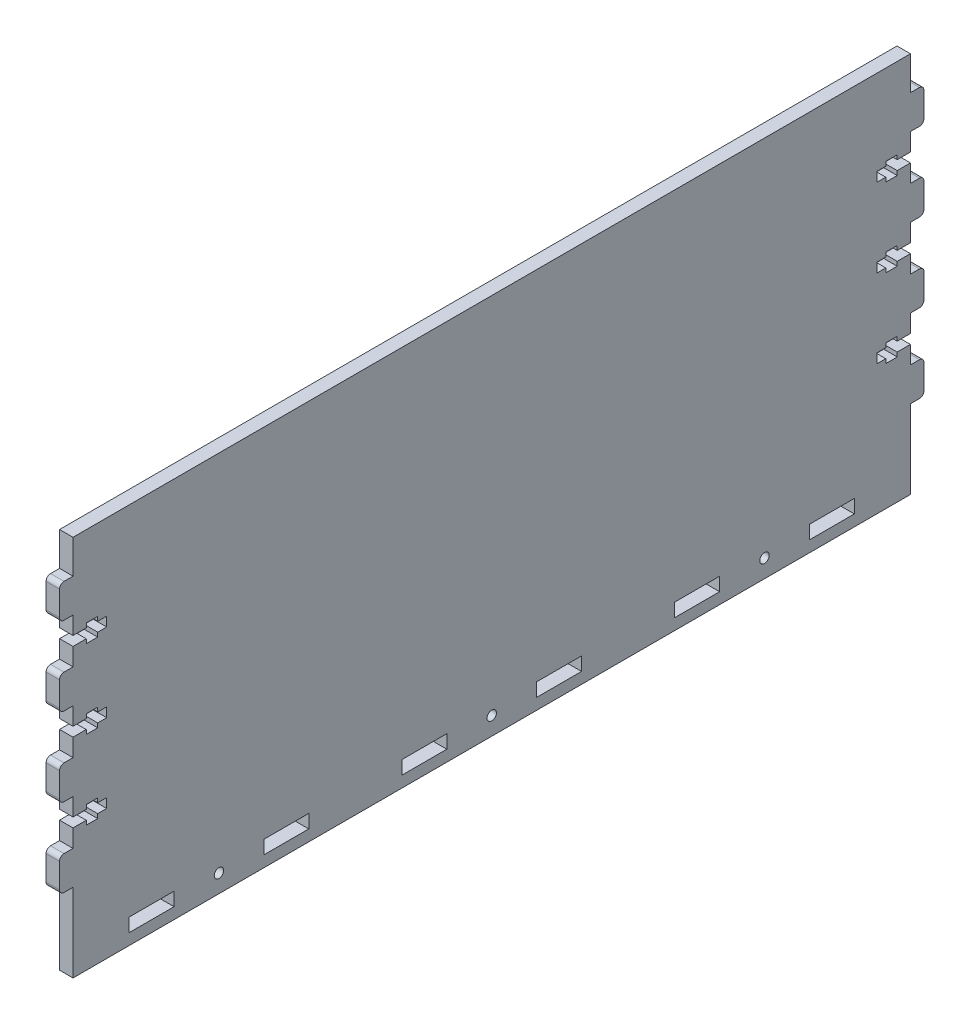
SolidWorks part; units mm, degrees
ref_plane "Спереди" through (0, 0, 0) normal (0, 0, 1) x (1, 0, 0)
ref_plane "Сверху" through (0, 0, 0) normal (0, 1, 0) x (1, 0, 0)
ref_plane "Справа" through (0, 0, 0) normal (1, 0, 0) x (0, 0, -1)
sketch "Эскиз1" plane through (0, 0, 0) normal (1, 0, 0) x (0, 0, -1)
  line L0 (186.5, 170) -> (186.5, 217.3961) construction
  line L1 (0, 0) -> (373, 0)
  line L2 (0, 0) -> (0, 170)
  line L3 (0, 170) -> (373, 170)
  line L4 (373, 0) -> (373, 170)
  line L5 (0, 155) -> (-4, 155)
  line L6 (0, 155) -> (0, 140)
  line L7 (0, 140) -> (-4, 140)
  line L8 (-6, 153) -> (-6, 142)
  line L9 (0, 120) -> (-4, 120)
  line L10 (0, 120) -> (0, 105)
  line L11 (0, 105) -> (-4, 105)
  line L12 (-6, 118) -> (-6, 107)
  line L13 (0, 85) -> (-4, 85)
  line L14 (0, 85) -> (0, 70)
  line L15 (0, 70) -> (-4, 70)
  line L16 (-6, 83) -> (-6, 72)
  line L17 (0, 50) -> (-4, 50)
  line L18 (0, 50) -> (0, 35)
  line L19 (0, 35) -> (-4, 35)
  line L20 (-6, 48) -> (-6, 37)
  line L21 (0, 132.1) -> (15, 132.1)
  line L22 (0, 132.1) -> (0, 127.9)
  line L23 (0, 127.9) -> (15, 127.9)
  line L24 (15, 132.1) -> (15, 127.9)
  line L25 (5.9, 134) -> (11, 134)
  line L26 (5.9, 134) -> (5.9, 126)
  line L27 (5.9, 126) -> (11, 126)
  line L28 (11, 134) -> (11, 126)
  line L29 (0, 62.1) -> (15, 62.1)
  line L30 (0, 62.1) -> (0, 57.9)
  line L31 (0, 57.9) -> (15, 57.9)
  line L32 (15, 62.1) -> (15, 57.9)
  line L33 (5.9, 64) -> (11, 64)
  line L34 (5.9, 64) -> (5.9, 56)
  line L35 (5.9, 56) -> (11, 56)
  line L36 (11, 64) -> (11, 56)
  line L37 (0, 97.1) -> (15, 97.1)
  line L38 (0, 97.1) -> (0, 92.9)
  line L39 (0, 92.9) -> (15, 92.9)
  line L40 (15, 97.1) -> (15, 92.9)
  line L41 (5.9, 99) -> (11, 99)
  line L42 (5.9, 99) -> (5.9, 91)
  line L43 (5.9, 91) -> (11, 91)
  line L44 (11, 99) -> (11, 91)
  line L45 (362, 99) -> (362, 91)
  line L46 (367.1, 91) -> (362, 91)
  line L47 (367.1, 99) -> (367.1, 91)
  line L48 (367.1, 99) -> (362, 99)
  line L49 (358, 97.1) -> (358, 92.9)
  line L50 (373, 92.9) -> (358, 92.9)
  line L51 (373, 97.1) -> (373, 92.9)
  line L52 (373, 97.1) -> (358, 97.1)
  line L53 (362, 64) -> (362, 56)
  line L54 (367.1, 56) -> (362, 56)
  line L55 (367.1, 64) -> (367.1, 56)
  line L56 (367.1, 64) -> (362, 64)
  line L57 (358, 62.1) -> (358, 57.9)
  line L58 (373, 57.9) -> (358, 57.9)
  line L59 (373, 62.1) -> (373, 57.9)
  line L60 (373, 62.1) -> (358, 62.1)
  line L61 (362, 134) -> (362, 126)
  line L62 (367.1, 126) -> (362, 126)
  line L63 (367.1, 134) -> (367.1, 126)
  line L64 (367.1, 134) -> (362, 134)
  line L65 (358, 132.1) -> (358, 127.9)
  line L66 (373, 127.9) -> (358, 127.9)
  line L67 (373, 132.1) -> (373, 127.9)
  line L68 (373, 132.1) -> (358, 132.1)
  line L69 (379, 48) -> (379, 37)
  line L70 (373, 35) -> (377, 35)
  line L71 (373, 50) -> (373, 35)
  line L72 (373, 50) -> (377, 50)
  line L73 (379, 83) -> (379, 72)
  line L74 (373, 70) -> (377, 70)
  line L75 (373, 85) -> (373, 70)
  line L76 (373, 85) -> (377, 85)
  line L77 (379, 118) -> (379, 107)
  line L78 (373, 105) -> (377, 105)
  line L79 (373, 120) -> (373, 105)
  line L80 (373, 120) -> (377, 120)
  line L81 (379, 153) -> (379, 142)
  line L82 (373, 140) -> (377, 140)
  line L83 (373, 155) -> (373, 140)
  line L84 (373, 155) -> (377, 155)
  arc A0 (-4, 155) -> (-6, 153) centre (-4, 153) ccw
  arc A1 (-4, 140) -> (-6, 142) centre (-4, 142) cw
  arc A2 (-4, 120) -> (-6, 118) centre (-4, 118) ccw
  arc A3 (-4, 105) -> (-6, 107) centre (-4, 107) cw
  arc A4 (-4, 85) -> (-6, 83) centre (-4, 83) ccw
  arc A5 (-4, 70) -> (-6, 72) centre (-4, 72) cw
  arc A6 (-4, 50) -> (-6, 48) centre (-4, 48) ccw
  arc A7 (-4, 35) -> (-6, 37) centre (-4, 37) cw
  arc A8 (377, 35) -> (379, 37) centre (377, 37) ccw
  arc A9 (377, 50) -> (379, 48) centre (377, 48) cw
  arc A10 (377, 70) -> (379, 72) centre (377, 72) ccw
  arc A11 (377, 85) -> (379, 83) centre (377, 83) cw
  arc A12 (377, 105) -> (379, 107) centre (377, 107) ccw
  arc A13 (377, 120) -> (379, 118) centre (377, 118) cw
  arc A14 (377, 140) -> (379, 142) centre (377, 142) ccw
  arc A15 (377, 155) -> (379, 153) centre (377, 153) cw
  point P45 (15, 95)
  point P46 (15, 60)
  point P47 (11, 60)
  point P48 (11, 95)
  point P49 (15, 130)
  point P50 (11, 130)
  point P55 (-6, 155)
  point P58 (-6, 140)
  point P61 (-6, 120)
  point P64 (-6, 105)
  point P67 (-6, 85)
  point P70 (-6, 70)
  point P73 (-6, 50)
  point P76 (-6, 35)
  point P133 (379, 35)
  point P134 (379, 50)
  point P135 (379, 70)
  point P136 (379, 85)
  point P137 (379, 105)
  point P138 (379, 120)
  point P139 (379, 140)
  point P140 (379, 155)
  point P141 (362, 130)
  point P142 (358, 130)
  point P143 (362, 95)
  point P144 (362, 60)
  point P145 (358, 60)
  point P146 (358, 95)
extrude "Бобышка-Вытянуть1" add sketch "Эскиз1" along normal blind 6 contours A7 L19 L2 L17 A6 L20 | A5 L15 L2 L13 A4 L16 | A3 L11 L2 L9 A2 L12 | A1 L7 L2 L5 A0 L8 | A9 L72 L4 L70 A8 L69 | A11 L76 L4 L74 A10 L73 | A13 L80 L4 L78 A12 L77 | A15 L84 L4 L82 A14 L81 | L68 L4 L3 L2 L21 L26 L25 L28 L24 L23 L27 L37 L42 L41 L44 L40 L39 L43 L29 L34 L33 L36 L32 L31 L35
sketch "Эскиз2" plane through (6, 0, 0) normal (1, 0, 0) x (0, 0, -1)
  line L0 (186.5, 0) -> (186.5, -18.7251) construction
  line L1 (25, 11) -> (45, 11)
  line L2 (25, 11) -> (25, 5)
  line L3 (25, 5) -> (45, 5)
  line L4 (45, 11) -> (45, 5)
  line L5 (85, 11) -> (105, 11)
  line L6 (85, 11) -> (85, 5)
  line L7 (85, 5) -> (105, 5)
  line L8 (105, 11) -> (105, 5)
  line L9 (146.5, 11) -> (166.5, 11)
  line L10 (146.5, 11) -> (146.5, 5)
  line L11 (146.5, 5) -> (166.5, 5)
  line L12 (166.5, 11) -> (166.5, 5)
  line L13 (0, 0) -> (373, 0) construction
  line L14 (0, 0) -> (0, 35) construction
  line L15 (206.5, 11) -> (206.5, 5)
  line L16 (226.5, 5) -> (206.5, 5)
  line L17 (226.5, 11) -> (226.5, 5)
  line L18 (226.5, 11) -> (206.5, 11)
  line L19 (268, 11) -> (268, 5)
  line L20 (288, 5) -> (268, 5)
  line L21 (288, 11) -> (288, 5)
  line L22 (288, 11) -> (268, 11)
  line L23 (328, 11) -> (328, 5)
  line L24 (348, 5) -> (328, 5)
  line L25 (348, 11) -> (348, 5)
  line L26 (348, 11) -> (328, 11)
  circle A0 centre (65, 8) radius 2.1
  circle A1 centre (186.5, 8) radius 2.1
  circle A2 centre (308, 8) radius 2.1
  point P20 (45, 8)
  point P21 (105, 8)
  point P22 (146.5, 8)
  point P39 (226.5, 8)
  point P40 (268, 8)
  point P41 (328, 8)
extrude "Вырез-Вытянуть1" cut sketch "Эскиз2" against normal through all
equation "\"D22@Эскиз1\"=\"D19@Эскиз1\"/2"
equation "\"D27@Эскиз1\"=\"D25@Эскиз1\"/2"
equation "\"D32@Эскиз1\"=\"D29@Эскиз1\"/2"
equation "\"D10@Эскиз2\"=\"D9@Эскиз2\"/2"
